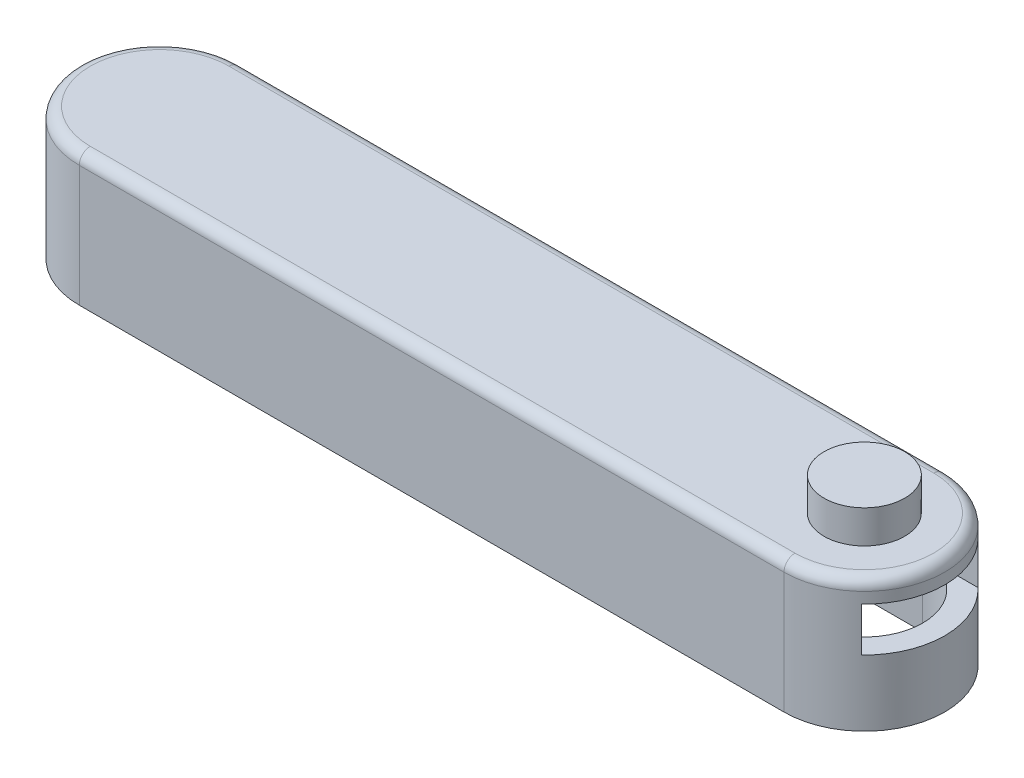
SolidWorks part; units mm, degrees
ref_plane "Front Plane" through (0, 0, 0) normal (0, 0, 1) x (1, 0, 0)
ref_plane "Top Plane" through (0, 0, 0) normal (0, 1, 0) x (1, 0, 0)
ref_plane "Right Plane" through (0, 0, 0) normal (1, 0, 0) x (0, 0, -1)
sketch "Sketch1"
  dimension "D1" = 92.71
  dimension "D2" = 203.2
extrude "Extrude1" add sketch "Sketch1" along normal blind 76.2
sketch "Sketch2"
  dimension "D1" = 12.7
extrude "Extrude2" cut sketch "Sketch2" against normal blind 38.1
sketch "Sketch3"
extrude "Extrude3" cut sketch "Sketch3" against normal blind 25.4
mirror "Mirror1" about plane through (0, 76.2, 0) normal (1, 0, 0)
fillet "Fillet1" radius 6.35 4 edges at (249.555, 76.2, -46.355) (0, 76.2, -92.71) (-249.555, 76.2, -46.355) (0, 76.2, 0)
sketch "Sketch4"
extrude "Extrude4" add sketch "Sketch4" along normal blind 19.05
